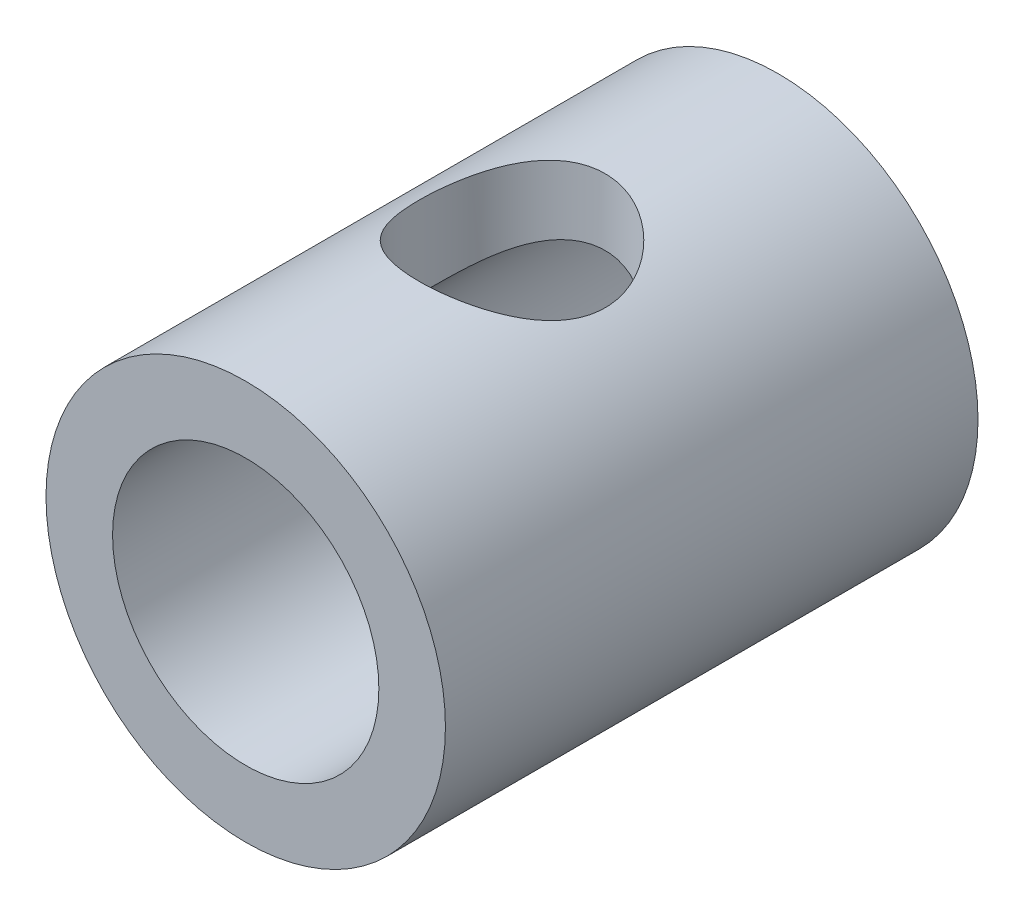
SolidWorks part; units mm, degrees
ref_plane "前视基准面" through (0, 0, 0) normal (0, 0, 1) x (1, 0, 0)
ref_plane "上视基准面" through (0, 0, 0) normal (0, 1, 0) x (1, 0, 0)
ref_plane "右视基准面" through (0, 0, 0) normal (1, 0, 0) x (0, 0, -1)
sketch "草图1" plane through (0, 0, 0) normal (0, 0, 1) x (1, 0, 0)
  circle A0 centre (0, 0) radius 15
  dimension "D1" = 30
extrude "拉伸1" add sketch "草图1" along normal blind 40
ref_plane "基准面1" through (0, 0, 20) normal (0, 0, 1) x (1, 0, 0)
sketch "草图3" plane through (0, 0, 40) normal (0, 0, 1) x (1, 0, 0)
  circle A0 centre (0, 0) radius 10
extrude "切除-拉伸1" cut sketch "草图3" against normal through all
sketch "草图6" plane through (0, 0, 0) normal (0, 1, 0) x (1, 0, 0)
  line L0 (-16.5, -20) -> (16.5, -20) construction
  circle A0 centre (0, -20) radius 7
  dimension "D1" = 14
extrude "切除-拉伸3" cut sketch "草图6" against normal through all and the other way through all
